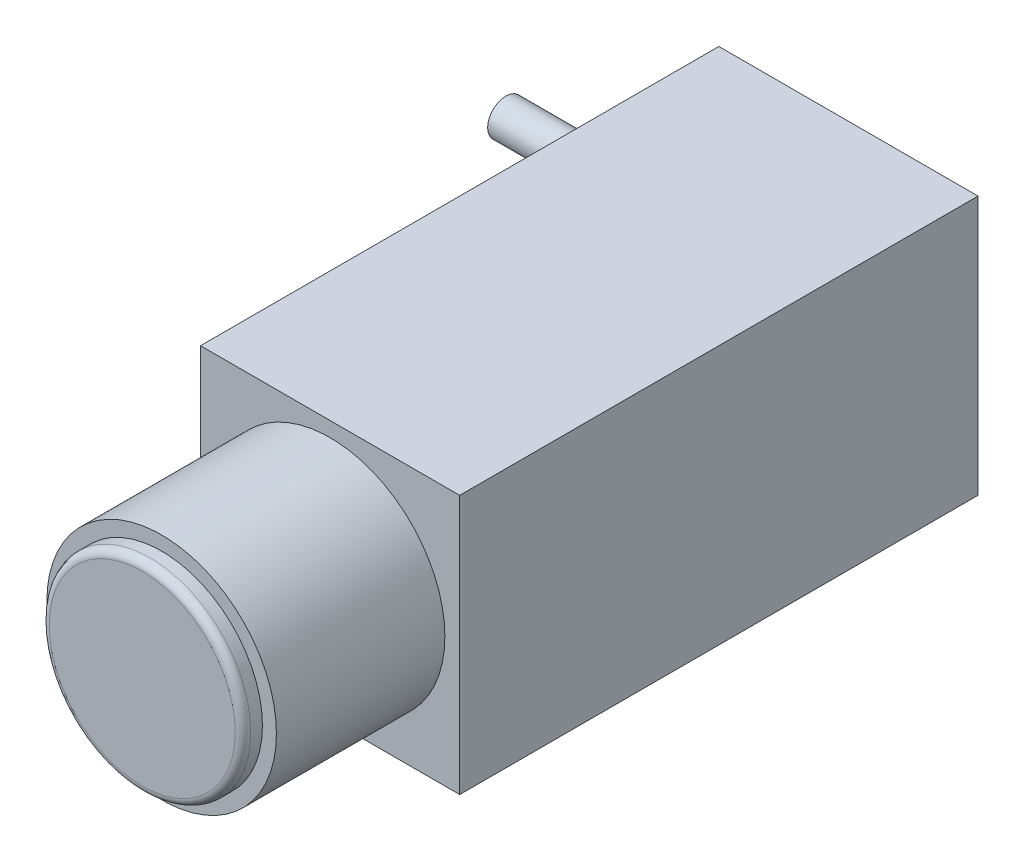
SolidWorks part; units mm, degrees
ref_plane "Front Plane" through (0, 0, 0) normal (0, 0, 1) x (1, 0, 0)
ref_plane "Top Plane" through (0, 0, 0) normal (0, 1, 0) x (1, 0, 0)
ref_plane "Right Plane" through (0, 0, 0) normal (1, 0, 0) x (0, 0, -1)
sketch "Sketch2" plane through (0, 0, 0) normal (0, 0, 1) x (1, 0, 0)
  line L1 (0, 0) -> (-25.4, 0)
  line L2 (0, 0) -> (0, 25.4)
  line L3 (0, 25.4) -> (-25.4, 25.4)
  line L4 (-25.4, 0) -> (-25.4, 25.4)
  dimension "D1" = 25.4
  dimension "D2" = 25.4
extrude "Boss-Extrude1" add sketch "Sketch2" along normal blind 50.8
sketch "Sketch3" plane through (0, 0, 50.8) normal (0, 0, 1) x (1, 0, 0)
  circle A0 centre (-12.7, 12.7) radius 11.249
extrude "Boss-Extrude2" add sketch "Sketch3" along normal blind 16.51
sketch "Sketch4" plane through (0, 0, 67.31) normal (0, 0, 1) x (1, 0, 0)
  circle A0 centre (-12.7, 12.7) radius 9.877
extrude "Boss-Extrude3" add sketch "Sketch4" along normal blind 1.905
fillet "Fillet3" radius 0.762 1 edges at (-2.823, 12.7, 69.215)
sketch "Sketch6" plane through (-25.4, 0, 0) normal (-1, 0, 0) x (0, 0, 1)
  circle A0 centre (3.7341, 12.7) radius 1.778
  dimension "D1" = 3.556
extrude "Boss-Extrude4" add sketch "Sketch6" along normal blind 17.145
